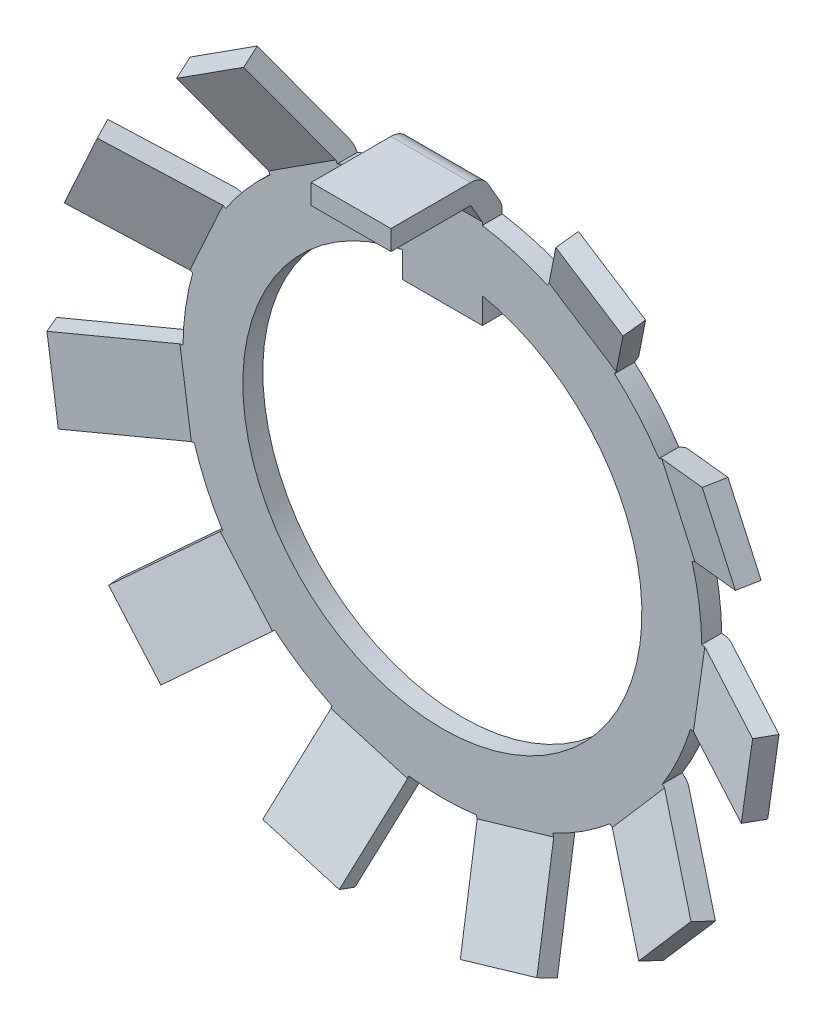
SolidWorks part; units mm, degrees
ref_plane "Face" through (0, 0, 0) normal (0, 0, 1) x (1, 0, 0)
ref_plane "Dessus" through (0, 0, 0) normal (0, 1, 0) x (1, 0, 0)
ref_plane "Droite" through (0, 0, 0) normal (1, 0, 0) x (0, 0, -1)
sketch "Esquisse1" plane through (0, 0, 0) normal (0, 0, 1) x (1, 0, 0)
  line L0 (0, -10) -> (0, 8.5) construction
  line L1 (-2, 8.5) -> (2, 8.5)
  line L2 (2, 8.5) -> (2, 9.798)
  line L3 (-2, 8.5) -> (-2, 9.798)
  line L4 (0, 0) -> (11, 0) construction
  arc A0 (-2, 9.798) -> (2, 9.798) centre (0, 0) ccw
  circle A1 centre (0, 0) radius 13
  dimension "dn" = 20
  dimension "d1" = 26
  dimension "f1" = 4
  dimension "M" = 18.5
  dimension "N" = 11
extrude "Base-Extrusion" add sketch "Esquisse1" along normal blind 1
ref_axis "Axe1" through (0, 0, -7.8059) along (0, 0, 1)
ref_plane "Plan1" through (0, 0, 0) normal (0.8413, 0.5406, 0) x (-0.5406, 0.8413, 0)
sketch "Esquisse2" plane through (0, 0, 0) normal (0.8413, 0.5406, 0) x (-0.5406, 0.8413, 0)
  line L0 (10, 0) -> (13, 0)
  line L1 (13.4226, 0.0937) -> (18, 2.2282)
  line L2 (0, 0) -> (0, 3) construction
  arc A0 (13, 0) -> (13.4226, 0.0937) centre (13, 1) ccw
  dimension "D3" = 1
  dimension "D1" = 10
  dimension "D2" = 13
  dimension "D4" = 25
  dimension "d5" = 36
extrude "Boss.-Extru.-Mince1" add sketch "Esquisse2" along normal mid plane 4 thin
pattern_circular "Répétition circulaire1" count 10 over 294.545 about axis through (0, 0, -7.8059) along (0, 0, 1) of "Boss.-Extru.-Mince1"
ref_plane "Plan2" through (0, 0, 0) normal (1, 0, 0) x (0, 0, -1)
sketch "Esquisse3" plane through (0, 0, 0) normal (1, 0, 0) x (0, 0, -1)
  line L0 (0, 10) -> (0, 13)
  line L1 (-0.134, 13.5) -> (-0.7113, 14.5)
  line L2 (-1.5774, 15) -> (-5.5774, 15)
  arc A0 (0, 13) -> (-0.134, 13.5) centre (-1, 13) ccw
  arc A1 (-0.7113, 14.5) -> (-1.5774, 15) centre (-1.5774, 14) ccw
  dimension "D1" = 1
  dimension "D2" = 30
  dimension "D3" = 10
  dimension "D4" = 13
  dimension "D5" = 4
  dimension "A" = 14
extrude "Boss.-Extru.-Mince2" add sketch "Esquisse3" along normal mid plane 4 thin
equation "\"teta@Plan1\"=360/\"N@Esquisse1\""
equation "\"D1@Esquisse2\" = \"dn@Esquisse1\"/2"
equation "\"D2@Esquisse2\" = \"d1@Esquisse1\"/2"
equation "\"D3@Esquisse2\" = \"e@Base-Extrusion\""
equation "\"e@Boss.-Extru.-Mince1\" = \"e@Base-Extrusion\""
equation "\"D1@Répétition circulaire1\" = \"N@Esquisse1\"-1"
equation "\"alpha@Répétition circulaire1\" = 360*(1-2/\"N@Esquisse1\")"
equation "\"beta@Plan2\" = \"teta@Plan1\""
equation "\"D1@Esquisse3\" = \"e@Base-Extrusion\""
equation "\"D3@Esquisse3\" = \"dn@Esquisse1\"/2"
equation "\"D4@Esquisse3\" = \"d1@Esquisse1\"/2"
equation "\"D5@Esquisse3\" = \"d5@Esquisse2\"/2-\"A@Esquisse3\""
equation "\"e@Boss.-Extru.-Mince2\" = \"e@Base-Extrusion\""
equation "\"g@Boss.-Extru.-Mince2\" = \"g@Boss.-Extru.-Mince1\""
